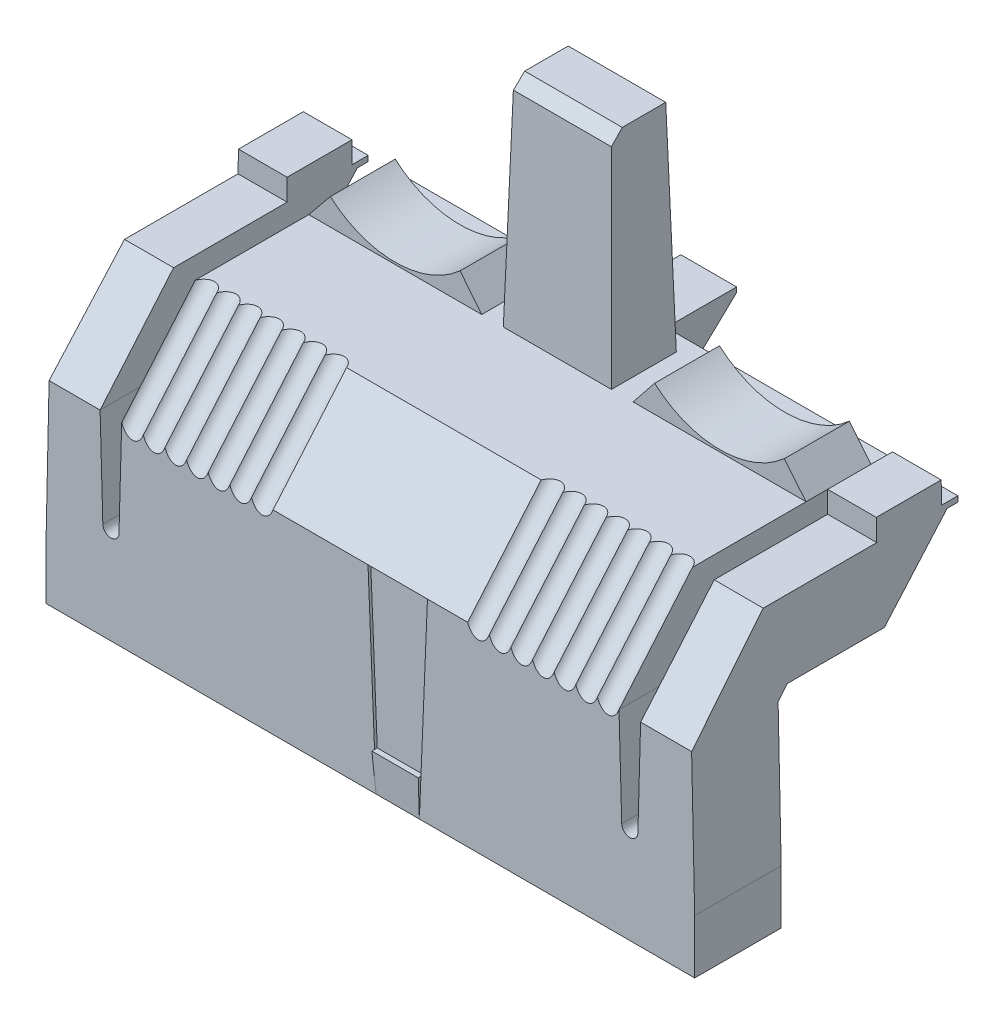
SolidWorks part; units mm, degrees
ref_plane "Plan de face" through (0, 0, 0) normal (0, 0, 1) x (1, 0, 0)
ref_plane "Plan de dessus" through (0, 0, 0) normal (0, 1, 0) x (1, 0, 0)
ref_plane "Plan de droite" through (0, 0, 0) normal (1, 0, 0) x (0, 0, -1)
sketch "Esquisse1" plane through (0, 0, 0) normal (1, 0, 0) x (0, 0, -1)
  line L0 (-4, -10) -> (4, -10)
  line L1 (4, -10) -> (4, 8)
  line L2 (-4, -10) -> (-4, 8)
  line L3 (-4, 8) -> (2.8007, 16)
  line L4 (2.8007, 16) -> (13.3007, 16)
  line L5 (4, 8) -> (4.8501, 9)
  line L6 (4.8501, 9) -> (13.8501, 9)
  line L7 (13.3007, 16) -> (13.3007, 36)
  line L8 (13.3007, 36) -> (19.3007, 36)
  line L9 (19.3007, 36) -> (19.3007, 16)
  line L10 (19.3007, 16) -> (20.8007, 16)
  line L11 (20.8007, 16) -> (20.8007, 15.5)
  line L12 (20.8007, 15.5) -> (19.8007, 15.5)
  line L13 (19.8007, 15.5) -> (13.8501, 9)
  dimension "D1" = 8
  dimension "D2" = 18
  dimension "D3" = 18
  dimension "D4" = 8
  dimension "D5" = 10.5
  dimension "D6" = 10.5
  dimension "D7" = 1
  dimension "D8" = 9
  dimension "D9" = 20
  dimension "D10" = 6
  dimension "D11" = 20
  dimension "D12" = 1.5
  dimension "D13" = 0.5
  dimension "D14" = 1
  dimension "D15" = 4
  dimension "D16" = 10
  dimension "D17" = 8.8125
extrude "Extrusion1" add sketch "Esquisse1" along normal mid plane 60
sketch "Esquisse3" plane through (0, 0, 4) normal (0, 0, 1) x (1, 0, 0)
  line L0 (-30, -5) -> (-30, 37.0193)
  line L1 (30, -10) -> (-30, -10) construction
  line L2 (0, 37.8792) -> (0, -12.942) construction
  line L3 (-21, 18.4528) -> (-9, 18.5)
  line L4 (-30, 37.0193) -> (-5, 37.0193)
  line L5 (-25, 18) -> (-25, 8)
  line L6 (30, 8) -> (-30, 8) construction
  line L7 (-23, 16) -> (-23, 8)
  line L8 (-29.5, 18) -> (-25, 18)
  line L10 (-30, -5) -> (-29.5, 18)
  line L12 (21, 18.4528) -> (9, 18.5)
  line L13 (-5, 37.0193) -> (-5, 16)
  line L14 (5, 37.0193) -> (30, 37.0193)
  line L15 (30, -5) -> (30, 37.0193)
  line L16 (-25, 8) -> (-24.7466, -1.021)
  line L17 (-23, 8) -> (-23.2534, -1.021)
  line L20 (-23, 16) -> (-21, 18.4528)
  line L21 (-7, 16) -> (-9, 18.5)
  line L22 (30, 16) -> (-30, 16) construction
  line L23 (-7, 16) -> (-5, 16)
  line L24 (7, 16) -> (5, 16)
  line L25 (5, 37.0193) -> (5, 16)
  line L27 (7, 16) -> (9, 18.5)
  line L29 (23, 16) -> (21, 18.4528)
  line L30 (23, 16) -> (23, 8)
  line L31 (23, 8) -> (23.2534, -1.021)
  line L32 (25, 8) -> (24.7466, -1.021)
  line L33 (25, 18) -> (25, 8)
  line L34 (25, 18) -> (29.5, 18)
  line L35 (30, -5) -> (29.5, 18)
  arc A0 (-24.7466, -1.021) -> (-23.2534, -1.021) centre (-24, -1) ccw
  arc A1 (24.7466, -1.021) -> (23.2534, -1.021) centre (24, -1) cw
  dimension "D9" = 9
  dimension "D12" = 0.7469
  dimension "D14" = 0.5
  dimension "D2" = 8
  dimension "D3" = 4.5
  dimension "D4" = 2
  dimension "D5" = 10
  dimension "D6" = 2
  dimension "D7" = 4
  dimension "D8" = 42.0193
  dimension "D10" = 25
  dimension "D11" = 16
  dimension "D13" = 2
  dimension "D15" = 12.0001
  dimension "D16" = 10
  dimension "D17" = 2.5
  dimension "D18" = 23
  dimension "D19" = 5
  dimension "D20" = 9.021
extrude "Enlèv. mat.-Extru.1" cut sketch "Esquisse3" against normal through all
sketch "Esquisse4" plane through (0, 0, 4) normal (0, 0, 1) x (1, 0, 0)
  line L0 (0, 37.4199) -> (0, 12.2219) construction
  circle A0 centre (-15.0264, 25.1845) radius 9
  circle A1 centre (15.0264, 25.1845) radius 9
extrude "Enlèv. mat.-Extru.2" cut sketch "Esquisse4" against normal through all
draft "Dépouille3" type of draft neutral plane draft angle 1.4 faces to draft 1 parameters "D1"=1.4
draft "Dépouille4" type of draft neutral plane draft angle 1.4 faces to draft 1 parameters "D1"=1.4
draft "Dépouille5" type of draft neutral plane draft angle 1.4 faces to draft 1 parameters "D1"=1.4
draft "Dépouille6" type of draft neutral plane draft angle 1.4 faces to draft 1 parameters "D1"=1.4
chamfer "Chanfrein2" distance 1 angle 45 1 edges at (0, 36, -13.7895)
sketch "Esquisse7" plane through (0, 0, 0) normal (1, 0, 0) x (0, 0, -1)
  line L0 (5.5, 6.5) -> (6, -2.5)
  line L1 (6, -2.5) -> (10, -2.5)
  line L2 (13.8501, 9) -> (4.8501, 9) construction
  line L3 (4, 8) -> (4, -5) construction
  line L4 (19.8007, 15.5) -> (27.3007, 15.5)
  line L5 (27.3007, 15.5) -> (10, -2.5)
  line L6 (19.8007, 15.5) -> (13.8501, 9)
  line L7 (13.8501, 9) -> (4.8501, 9)
  line L8 (4.8501, 9) -> (4, 8)
  arc A0 (5.5, 6.5) -> (4, 8) centre (3.9118, 6.4118) ccw
  dimension "D5" = 9
  dimension "D1" = 11.5
  dimension "D2" = 4
  dimension "D3" = 2
  dimension "D4" = 1.5
  dimension "D6" = 7.5
extrude "Extrusion2" add sketch "Esquisse7" along normal mid plane 4.5
sketch "Esquisse8" plane through (2.25, 0, 0) normal (1, 0, 0) x (0, 0, -1)
  line L0 (20.8007, 15.5) -> (20.8007, 16)
  line L1 (20.8007, 16) -> (27.3007, 16)
  line L2 (27.3007, 16) -> (27.3007, 15.5)
  line L3 (27.3007, 15.5) -> (20.8007, 15.5)
extrude "Extrusion3" add sketch "Esquisse8" against normal blind 4.5
draft "Dépouille7" type of draft neutral plane draft angle 2.7 faces to draft 1 parameters "D1"=2.7
draft "Dépouille8" type of draft neutral plane draft angle 2.7 faces to draft 1 parameters "D1"=2.7
sketch "Esquisse9" plane through (0, 0, 4) normal (0, 0, 1) x (1, 0, 0)
  line L0 (-0.2174, 8) -> (0.5326, -10)
  line L1 (23, 8) -> (-23, 8) construction
  line L2 (30, -10) -> (-30, -10) construction
  line L3 (0.5326, -10) -> (4.5326, -10)
  line L4 (4.5326, -10) -> (5.2826, 8)
  line L5 (5.2826, 8) -> (-0.2174, 8)
  dimension "D1" = 4
  dimension "D2" = 5.5
  dimension "D3" = 29.5
  dimension "D4" = 0.75
extrude "Enlèv. mat.-Extru.4" cut sketch "Esquisse9" against normal blind 0.25
sketch "Esquisse10" plane through (0, 0, 3.75) normal (0, 0, 1) x (1, 0, 0)
  line L0 (0.5326, -10) -> (4.5326, -10)
  line L1 (4.5326, -10) -> (4.6784, -6.5)
  line L2 (4.5326, -10) -> (5.2826, 8) construction
  line L3 (4.6784, -6.5) -> (0.3868, -6.5)
  line L4 (-0.2174, 8) -> (0.5326, -10) construction
  line L5 (0.3868, -6.5) -> (0.5326, -10)
  dimension "D1" = 3.5
extrude "Extrusion4" add sketch "Esquisse10" along normal blind 0.5
sketch "Esquisse11" plane through (0, 0, 0) normal (1, 0, 0) x (0, 0, -1)
  line L0 (-4.25, -6.5) -> (-4, -10)
  line L1 (-4.25, -6.5) -> (-4.25, -10)
  line L2 (-4.25, -10) -> (-4, -10)
extrude "Enlèv. mat.-Extru.6" cut sketch "Esquisse11" along normal through all
sketch "Esquisse12" plane through (0, 0, -4) normal (0, 0, -1) x (-1, 0, 0)
  line L0 (28.8, 11.9292) -> (28.2, -4)
  line L1 (28.2, -4) -> (27.2, -4)
  line L2 (27.2, -4) -> (26.6, 11.9292)
  line L3 (26.6, 11.9292) -> (28.8, 11.9292)
  line L4 (-30, -10) -> (30, -10) construction
  line L5 (30, -10) -> (30, -5) construction
  line L6 (0, 20.6063) -> (0, -14.1258) construction
  line L7 (-26.6, 11.9292) -> (-28.8, 11.9292)
  line L8 (-28.8, 11.9292) -> (-28.2, -4)
  line L9 (-27.2, -4) -> (-26.6, 11.9292)
  line L10 (-28.2, -4) -> (-27.2, -4)
  dimension "D1" = 1
  dimension "D2" = 2.2
  dimension "D3" = 6
  dimension "D4" = 0.6
  dimension "D5" = 15.9292
  dimension "D6" = 1.2
extrude "Extrusion5" add sketch "Esquisse12" along normal blind 1
sketch "Esquisse13" plane through (0, 0, -4) normal (0, 0, -1) x (-1, 0, 0)
  line L0 (3, -9.5) -> (3, 11.2203)
  line L1 (3, 11.2203) -> (4, 11.2203)
  line L2 (4, 11.2203) -> (4, -9.5)
  line L3 (4, -9.5) -> (3, -9.5)
  line L4 (30, -10) -> (30, -5) construction
  line L5 (-30, -10) -> (30, -10) construction
  dimension "D1" = 1
  dimension "D2" = 26
  dimension "D3" = 0.5
  dimension "D4" = 20.7203
extrude "Extrusion6" add sketch "Esquisse13" along normal blind 1
sketch "Esquisse14" plane through (0, 0.481, -19.68) normal (0, 0.0244, -0.9997) x (-1, 0, 0)
  line L0 (-4.5112, 35.5296) -> (4.5112, 35.5296) construction
  line L1 (-2.5, 31.5296) -> (2.5, 31.5296)
  line L2 (-2.5, 31.5296) -> (-2.5, 28.0296)
  line L3 (-2.5, 28.0296) -> (2.5, 28.0296)
  line L4 (2.5, 31.5296) -> (2.5, 28.0296)
  line L5 (30, -4.9008) -> (30, -9.8993) construction
  point P4 (0, 35.5296)
  point P7 (30, -7.4)
  dimension "D1" = 4
  dimension "D2" = 3.5
  dimension "D3" = 5
  dimension "D4" = 27.5
extrude "Enlèv. mat.-Extru.8" cut sketch "Esquisse14" against normal blind 3
ref_plane "Plan1" through (0, 2.6701, -2.2698) normal (0, 0.7619, -0.6477) x (-1, 0, 0)
sketch "Esquisse15" plane through (0, 2.6701, -2.2698) normal (0, 0.7619, -0.6477) x (-1, 0, 0)
  line L1 (0.2174, 8.2291) -> (23, 8.2291) construction
  line L2 (9, 8.2291) -> (9, 10.7006)
  line L3 (9, 10.7006) -> (23, 10.4341)
  line L4 (23, 10.4341) -> (23, 8.2291)
  line L5 (0, 0) -> (0, 27.746) construction
  line L6 (-23, 10.4341) -> (-23, 8.2291)
  line L7 (-9, 10.7006) -> (-23, 10.4341)
  line L8 (-9, 8.2291) -> (-9, 10.7006)
  arc A0 (23, 8.2291) -> (21, 8.2291) centre (22, 8.7755) cw
  arc A1 (21, 8.2291) -> (19, 8.2291) centre (20, 8.7755) cw
  arc A2 (19, 8.2291) -> (17, 8.2291) centre (18, 8.7755) cw
  arc A3 (17, 8.2291) -> (15, 8.2291) centre (16, 8.7755) cw
  arc A4 (15, 8.2291) -> (13, 8.2291) centre (14, 8.7755) cw
  arc A5 (13, 8.2291) -> (11, 8.2291) centre (12, 8.7755) cw
  arc A6 (11, 8.2291) -> (9, 8.2291) centre (10, 8.7755) cw
  arc A7 (-11, 8.2291) -> (-9, 8.2291) centre (-10, 8.7755) ccw
  arc A8 (-13, 8.2291) -> (-11, 8.2291) centre (-12, 8.7755) ccw
  arc A9 (-15, 8.2291) -> (-13, 8.2291) centre (-14, 8.7755) ccw
  arc A10 (-17, 8.2291) -> (-15, 8.2291) centre (-16, 8.7755) ccw
  arc A11 (-19, 8.2291) -> (-17, 8.2291) centre (-18, 8.7755) ccw
  arc A12 (-21, 8.2291) -> (-19, 8.2291) centre (-20, 8.7755) ccw
  arc A13 (-23, 8.2291) -> (-21, 8.2291) centre (-22, 8.7755) ccw
  dimension "D2" = 1.1395
  dimension "D1" = 2
extrude "Enlèv. mat.-Extru.9" cut sketch "Esquisse15" against normal mid plane 50
